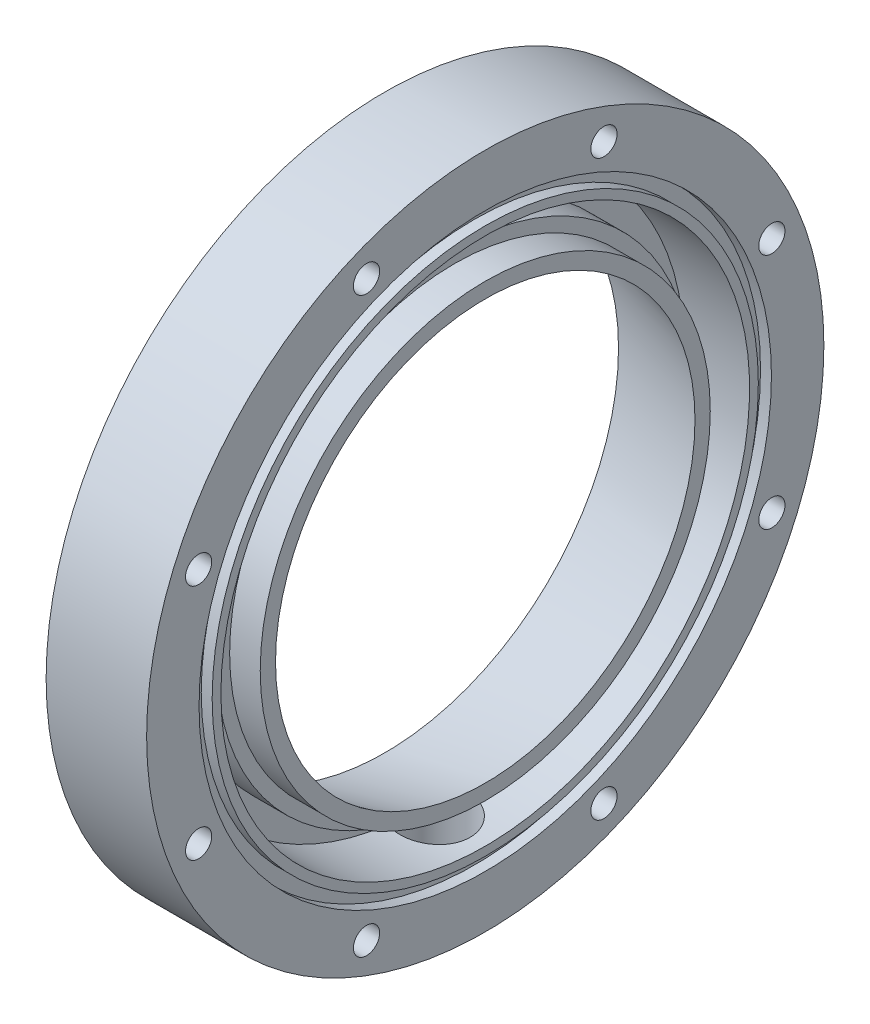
SolidWorks part; units mm, degrees
ref_plane "Спереди" through (0, 0, 0) normal (0, 0, 1) x (1, 0, 0)
ref_plane "Сверху" through (0, 0, 0) normal (0, 1, 0) x (1, 0, 0)
ref_plane "Справа" through (0, 0, 0) normal (1, 0, 0) x (0, 0, -1)
sketch "Эскиз1" plane through (0, 0, 0) normal (0, 0, 1) x (1, 0, 0)
  line L0 (0, 0) -> (49.4869, 0) construction
  line L1 (-7, 54.5) -> (-7, 51.5)
  line L2 (-23, 77.5) -> (0, 77.5)
  line L3 (0, 60.5) -> (-15, 60.5)
  line L4 (-15, 60.5) -> (-15, 54.5)
  line L5 (-15, 54.5) -> (-7, 54.5)
  line L6 (-7, 51.5) -> (0, 51.5)
  line L7 (0, 62.5) -> (-2.5, 62.5)
  line L9 (0, 48) -> (-23, 53.5)
  line L10 (-2.5, 62.5) -> (-2.5, 65.5)
  line L11 (-2.5, 65.5) -> (0, 65.5)
  line L12 (0, 65.5) -> (0, 77.5)
  line L13 (0, 62.5) -> (0, 60.5)
  line L14 (-23, 77.5) -> (-23, 53.5)
  line L18 (0, 51.5) -> (0, 48)
  dimension "D1" = 96
  dimension "D2" = 155
  dimension "D3" = 125
  dimension "D4" = 107
  dimension "D5" = 3
  dimension "D6" = 15
  dimension "D7" = 2
  dimension "D8" = 6
  dimension "D9" = 2.5
  dimension "D10" = 3
  dimension "D11" = 7
  dimension "D12" = 23
revolve "Повернуть1" add sketch "Эскиз1" angle 360 about L0
sketch "Эскиз2" plane through (-23, 0, 0) normal (1, 0, 0) x (0, 0, -1)
  line L0 (0, 0) -> (-27.1705, 65.5954) construction
  line L1 (0, 0) -> (0, 71) construction
  circle A0 centre (-27.1705, 65.5954) radius 3
  circle A1 centre (0, 0) radius 71 construction
  dimension "D1" = 6
  dimension "D2" = 142
  dimension "D3" = 22.5
extrude "Вырез-Вытянуть1" cut sketch "Эскиз2" along normal through all
sketch "Эскиз3" plane through (-23, 0, 0) normal (-1, 0, 0) x (0, 0, 1)
  circle A0 centre (27.1705, 65.5954) radius 4.75
  dimension "D1" = 9.5
extrude "Вырез-Вытянуть2" cut sketch "Эскиз3" against normal blind 4
pattern_circular "Круговой массив1" count 8 over 360 about axis through (0, 0, 0) along (1, 0, 0) of "Вырез-Вытянуть2", "Вырез-Вытянуть1"
ref_plane "Плоскость1" through (-11.5, 0, -77.5) normal (0, 0, -1) x (0, -1, 0)
hole_wizard "1/8 NPT Tapped Hole2" positions "Эскиз7" profile "Эскиз6" size "1/8" standard "Ansi Inch"
sketch "Эскиз7" plane through (6, 0, -90) normal (0, 0, -1) x (0, -1, 0)
  line L0 (0, 6) -> (0, -32) construction
  line L1 (-62.5, -32) -> (62.5, -32) construction
  line L3 (90, 6) -> (-90, 6) construction
  point P0 (0, 0)
  dimension "D1" = 6
sketch "Эскиз6" plane through (6, 0, -90) normal (1, 0, 0) x (0, 1, 0)
  line L0 (0, 0) -> (0, 21.2335)
  line L1 (4.2164, 18.7) -> (0, 21.2335)
  line L2 (-4.2164, 18.7) -> (0, 21.2335) construction
  line L3 (4.2164, 18.7) -> (4.2164, 14)
  line L4 (4.2164, 14) -> (4.5374, 14)
  line L5 (4.5374, 14) -> (4.9566, 0)
  line L6 (-4.5374, 14) -> (-4.9566, 0) construction
  line L7 (4.9566, 0) -> (0, 0)
  line L8 (0, -6.35) -> (0, 107.95) construction
  line L11 (-4.2164, 14) -> (-4.5374, 14) construction
  dimension "Диаметр сверла" = 8.4328
  dimension "Глубина сверла" = 18.7
  dimension "Диаметр резьбы" = 9.9132
  dimension "Угол резьбы" = 3.43
  dimension "Глубина резьбы" = 14
  dimension "Угол заточки сверла" = 118
sketch "Эскиз10" plane through (0, 0, 0) normal (1, 0, 0) x (0, 0, -1)
  circle A0 centre (0, 0) radius 55
  circle A1 centre (0, 0) radius 52
  dimension "D1" = 104
  dimension "D2" = 110
extrude "Вырез-Вытянуть6" [suppressed] cut sketch "Эскиз10" against normal blind 1
hole_wizard "Отверстие обработанное метчиком M10x1.01" positions "Эскиз12" profile "Эскиз11" tap size "M10x1.0" standard "Iso"
sketch "Эскиз12" plane through (-7.1685, -25.6561, -13.556) normal (-1, 0, 0) x (0, 0, 1)
  line L0 (13.556, 25.6561) -> (13.556, -30.3439) construction
  point P0 (13.556, -30.3439)
  dimension "D1" = 56
sketch "Эскиз11" plane through (-7.1685, -56, 0) normal (0, 1, 0) x (0, 0, 1)
  line L0 (0, 0) -> (0, 25.7039)
  line L1 (0, 25.7039) -> (4.5, 23)
  line L2 (4.5, 23) -> (4.5, 0.525)
  line L3 (4.5, 0.525) -> (5.025, 0)
  line L5 (5.025, 0) -> (0, 0)
  line L6 (-4.5, 0.525) -> (-5.025, 0) construction
  line L10 (0, 25.7039) -> (-4.5, 23) construction
  line L11 (0, -6.35) -> (0, 107.95) construction
  dimension "Диаметр сверла" = 9
  dimension "Глубина сверла" = 23
  dimension "Диаметр передней зенковки" = 10.05
  dimension "Угол передней зенковки" = 90
  dimension "Угол заточки сверла" = 118
hole_wizard "Диаметр отверстия Ø3.0 (3)1" positions "Трехмерный эскиз2" profile "Эскиз13" hole size "Ø3.0" standard "Iso"
sketch3d "Трехмерный эскиз2"
  point P0 (-10, 45.8, 0)
  dimension "D1" = 10
sketch "Эскиз13" plane through (-10, 45.8, 0) normal (0, 0, 1) x (0.9766, 0.2149, 0)
  line L0 (0, 0) -> (0, 10.9013)
  line L1 (0, 10.9013) -> (1.5, 10)
  line L2 (1.5, 10) -> (1.5, 0)
  line L5 (1.5, 0) -> (0, 0)
  line L10 (0, 10.9013) -> (-1.5, 10) construction
  line L11 (0, -6.35) -> (0, 107.95) construction
  dimension "Диаметр отверстия" = 3
  dimension "Глубина отверстия" = 10
  dimension "Угол заточки сверла" = 118
pattern_circular "Круговой массив2" [suppressed] count 6 over 360
ref_plane "Плоскость2" through (0, -77.5, 0) normal (0, -1, 0) x (-1, 0, 0)
sketch "Эскиз14" plane through (0, -77.5, 0) normal (0, -1, 0) x (-1, 0, 0)
  line L0 (0, 0) -> (23, 0) construction
  line L1 (23, -77.5) -> (23, 77.5) construction
  circle A0 centre (11.5, 0) radius 8
  dimension "D1" = 16
extrude "Вырез-Вытянуть7" cut sketch "Эскиз14" against normal blind 20
chamfer "Фаска1" distance 1 angle 45 1 edges at (-9.7078, -77.1068, 7.7967)
